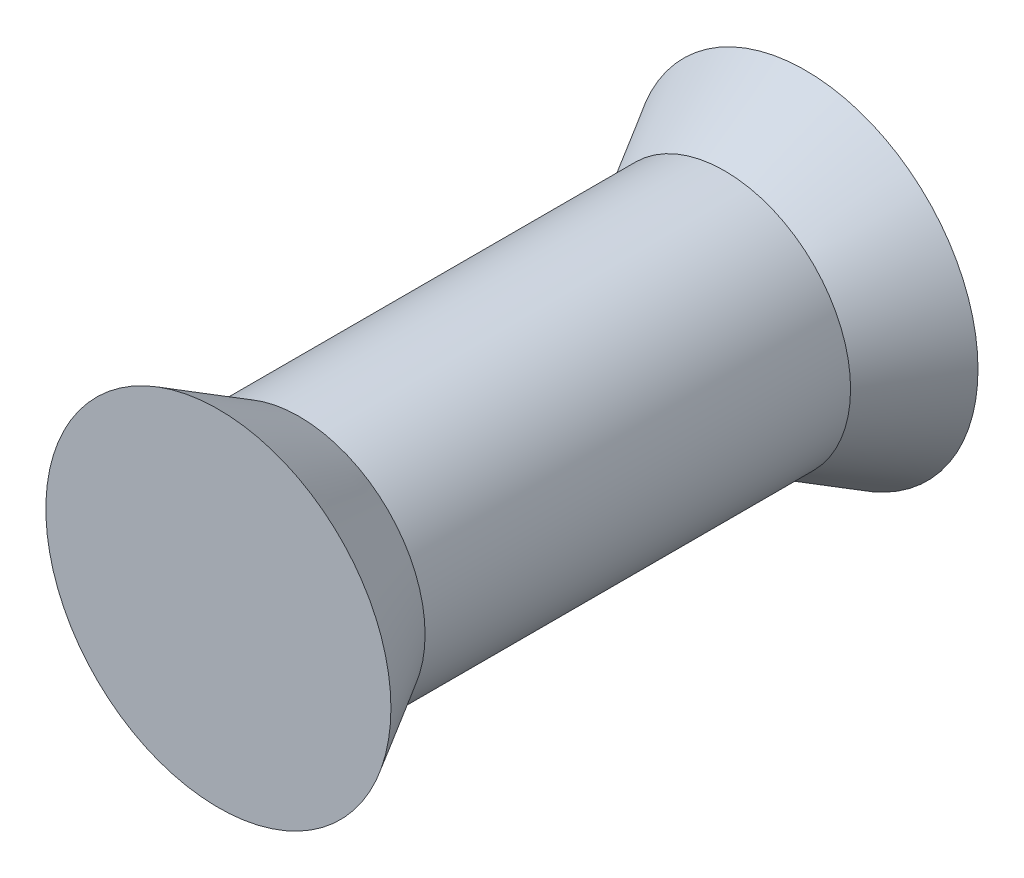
SolidWorks part; units mm, degrees
ref_plane "Спереди" through (0, 0, 0) normal (0, 0, 1) x (1, 0, 0)
ref_plane "Сверху" through (0, 0, 0) normal (0, 1, 0) x (1, 0, 0)
ref_plane "Справа" through (0, 0, 0) normal (1, 0, 0) x (0, 0, -1)
sketch "Эскиз1" plane through (0, 0, 0) normal (1, 0, 0) x (0, 0, -1)
  line L0 (0, 0) -> (36.9579, 0) construction
  line L1 (0, 3.2548) -> (0, 0)
  line L2 (0, 0) -> (11.0744, 0)
  line L3 (11.0744, 0) -> (11.0744, 3.2548)
  line L4 (11.0744, 3.2548) -> (9.5504, 2.3749)
  line L5 (9.5504, 2.3749) -> (1.524, 2.3749)
  line L6 (1.524, 2.3749) -> (0, 3.2548)
  dimension "D1" = 30
  dimension "D2" = 30
  dimension "D3" = 11.0744
  dimension "D4" = 1.524
  dimension "D5" = 1.524
  dimension "D6" = 4.7498
revolve "Повернуть1" add sketch "Эскиз1" angle 360 about L0
